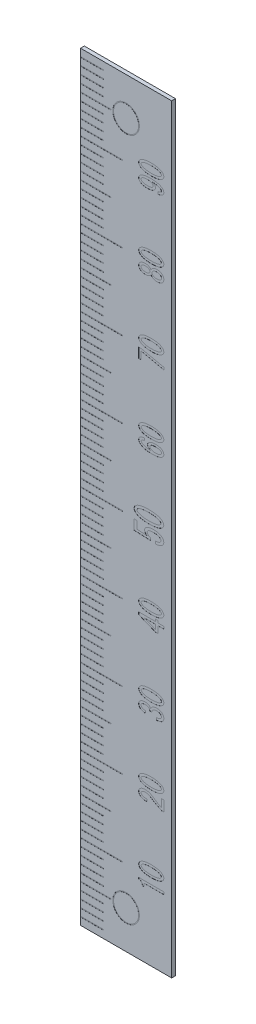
SolidWorks part; units mm, degrees
ref_plane "Front" through (0, 0, 0) normal (0, 0, 1) x (1, 0, 0)
ref_plane "Top" through (0, 0, 0) normal (0, 1, 0) x (1, 0, 0)
ref_plane "Right" through (0, 0, 0) normal (1, 0, 0) x (0, 0, -1)
sketch "Sketch1" plane through (0, 0, 0) normal (0, 0, 1) x (1, 0, 0)
  line L1 (0, 0) -> (0, 100)
  line L2 (0, 0) -> (12, 0)
  line L3 (12, 0) -> (12, 100)
  line L4 (0, 100) -> (12, 100)
  dimension "D1" = 100
  dimension "D2" = 12
extrude "Extrude1" add sketch "Sketch1" along normal blind 0.5
sketch "Sketch2" plane through (0, 0, 0.5) normal (0, 0, 1) x (1, 0, 0)
  line L0 (0, 100) -> (0, 0) construction
  line L1 (0, 0) -> (12, 0) construction
  line L2 (12, 100) -> (0, 100) construction
  circle A0 centre (6, 5) radius 1.75
  circle A1 centre (6, 95) radius 1.75
  circle A2 centre (6, 5) radius 1.65
  circle A3 centre (6, 95) radius 1.65
  dimension "D1" = 6
  dimension "D2" = 6
  dimension "D3" = 5
  dimension "D4" = 5
  dimension "D5" = 3.5
  dimension "D6" = 3.5
  dimension "D7" = 0.1
extrude "Extrude2" cut sketch "Sketch2" against normal blind 0.01
sketch "Sketch3" plane through (0, 0, 0.5) normal (0, 0, 1) x (1, 0, 0)
  line L0 (12, 100) -> (0, 100) construction
  line L1 (7.5, 88.25) -> (11, 88.25) construction
  line L2 (7.5, 88.25) -> (7.5, 91.75) construction
  line L3 (7.5, 91.75) -> (11, 91.75) construction
  line L4 (11, 88.25) -> (11, 91.75) construction
  line L6 (11, 78.25) -> (11, 81.75) construction
  line L7 (11, 68.25) -> (11, 71.75) construction
  line L8 (11, 58.25) -> (11, 61.75) construction
  line L9 (11, 48.25) -> (11, 51.75) construction
  line L10 (11, 38.25) -> (11, 41.75) construction
  line L11 (11, 28.25) -> (11, 31.75) construction
  line L12 (11, 18.25) -> (11, 21.75) construction
  line L13 (11, 8.25) -> (11, 11.75) construction
  line L14 (12, 0) -> (12, 100) construction
  line L16 (11, -1.75) -> (11, 1.75) construction
  text T0 "90" font "ＭＳ ゴシック" height in points 11
  text T1 "80  " font "ＭＳ ゴシック" height in points 11
  text T2 "70" font "ＭＳ ゴシック" height in points 11
  text T3 "60" font "ＭＳ ゴシック" height in points 11
  text T4 "50" font "ＭＳ ゴシック" height in points 13
  text T5 "40  " font "ＭＳ ゴシック" height in points 11
  text T6 "30" font "ＭＳ ゴシック" height in points 11
  text T7 "20" font "ＭＳ ゴシック" height in points 11
  text T8 "10" font "ＭＳ ゴシック" height in points 11
  point P4 (11, 90)
  dimension "D1" = 3.5
  dimension "D2" = 10
  dimension "D3" = 1
  dimension "D4" = 3.5
  dimension "D5" = 4
  dimension "D6" = 7
extrude "Extrude3" cut sketch "Sketch3" against normal blind 0.01
sketch "Sketch4" plane through (0, 0, 0.5) normal (0, 0, 1) x (1, 0, 0)
  line L5 (12, 100) -> (0, 100) construction
  line L406 (6, 100) -> (6, 0) construction
  line L407 (0, 0) -> (12, 0) construction
  line L408 (3, 1.05) -> (3, 0.95)
  line L409 (0, 0.95) -> (3, 0.95)
  line L410 (0, 1.05) -> (3, 1.05)
  line L411 (0, 1.05) -> (0, 0.95)
  line L412 (3, 2.05) -> (3, 1.95)
  line L413 (0, 1.95) -> (3, 1.95)
  line L414 (0, 2.05) -> (3, 2.05)
  line L415 (0, 2.05) -> (0, 1.95)
  line L416 (3, 3.05) -> (3, 2.95)
  line L417 (0, 2.95) -> (3, 2.95)
  line L418 (0, 3.05) -> (3, 3.05)
  line L419 (0, 3.05) -> (0, 2.95)
  line L420 (3, 4.05) -> (3, 3.95)
  line L421 (0, 3.95) -> (3, 3.95)
  line L422 (0, 4.05) -> (3, 4.05)
  line L423 (0, 4.05) -> (0, 3.95)
  line L424 (3, 6.05) -> (3, 5.95)
  line L425 (0, 5.95) -> (3, 5.95)
  line L426 (0, 6.05) -> (3, 6.05)
  line L427 (0, 6.05) -> (0, 5.95)
  line L428 (3, 7.05) -> (3, 6.95)
  line L429 (0, 6.95) -> (3, 6.95)
  line L430 (0, 7.05) -> (3, 7.05)
  line L431 (0, 7.05) -> (0, 6.95)
  line L432 (3, 8.05) -> (3, 7.95)
  line L433 (0, 7.95) -> (3, 7.95)
  line L434 (0, 8.05) -> (3, 8.05)
  line L435 (3, 9.05) -> (3, 8.95)
  line L436 (0, 8.95) -> (3, 8.95)
  line L437 (0, 9.05) -> (0, 8.95)
  line L438 (0, 9.05) -> (3, 9.05)
  line L439 (4, 4.95) -> (4, 5.05)
  line L440 (0, 5.05) -> (4, 5.05)
  line L441 (0, 4.95) -> (0, 5.05)
  line L442 (0, 4.95) -> (4, 4.95)
  line L443 (0, 8.05) -> (0, 7.95)
  line L444 (0, 9.95) -> (0, 10.05)
  line L445 (5.5, 9.95) -> (0, 9.95)
  line L446 (5.5, 10.05) -> (5.5, 9.95)
  line L447 (0, 10.05) -> (5.5, 10.05)
  line L448 (3, 11.05) -> (3, 10.95)
  line L449 (0, 10.95) -> (3, 10.95)
  line L450 (0, 11.05) -> (3, 11.05)
  line L451 (0, 11.05) -> (0, 10.95)
  line L452 (3, 12.05) -> (3, 11.95)
  line L453 (0, 11.95) -> (3, 11.95)
  line L454 (0, 12.05) -> (3, 12.05)
  line L455 (0, 12.05) -> (0, 11.95)
  line L456 (3, 13.05) -> (3, 12.95)
  line L457 (0, 12.95) -> (3, 12.95)
  line L458 (0, 13.05) -> (3, 13.05)
  line L459 (0, 13.05) -> (0, 12.95)
  line L460 (3, 14.05) -> (3, 13.95)
  line L461 (0, 13.95) -> (3, 13.95)
  line L462 (0, 14.05) -> (3, 14.05)
  line L463 (0, 14.05) -> (0, 13.95)
  line L464 (3, 16.05) -> (3, 15.95)
  line L465 (0, 15.95) -> (3, 15.95)
  line L466 (0, 16.05) -> (3, 16.05)
  line L467 (0, 16.05) -> (0, 15.95)
  line L468 (3, 17.05) -> (3, 16.95)
  line L469 (0, 16.95) -> (3, 16.95)
  line L470 (0, 17.05) -> (3, 17.05)
  line L471 (0, 17.05) -> (0, 16.95)
  line L472 (3, 18.05) -> (3, 17.95)
  line L473 (0, 17.95) -> (3, 17.95)
  line L474 (0, 18.05) -> (3, 18.05)
  line L475 (3, 19.05) -> (3, 18.95)
  line L476 (0, 18.95) -> (3, 18.95)
  line L477 (0, 19.05) -> (0, 18.95)
  line L478 (0, 19.05) -> (3, 19.05)
  line L479 (4, 14.95) -> (4, 15.05)
  line L480 (0, 15.05) -> (4, 15.05)
  line L481 (0, 14.95) -> (0, 15.05)
  line L482 (0, 14.95) -> (4, 14.95)
  line L483 (0, 18.05) -> (0, 17.95)
  line L484 (0, 19.95) -> (0, 20.05)
  line L485 (5.5, 19.95) -> (0, 19.95)
  line L486 (5.5, 20.05) -> (5.5, 19.95)
  line L487 (0, 20.05) -> (5.5, 20.05)
  line L488 (3, 21.05) -> (3, 20.95)
  line L489 (0, 20.95) -> (3, 20.95)
  line L490 (0, 21.05) -> (3, 21.05)
  line L491 (0, 21.05) -> (0, 20.95)
  line L492 (3, 22.05) -> (3, 21.95)
  line L493 (0, 21.95) -> (3, 21.95)
  line L494 (0, 22.05) -> (3, 22.05)
  line L495 (0, 22.05) -> (0, 21.95)
  line L496 (3, 23.05) -> (3, 22.95)
  line L497 (0, 22.95) -> (3, 22.95)
  line L498 (0, 23.05) -> (3, 23.05)
  line L499 (0, 23.05) -> (0, 22.95)
  line L500 (3, 24.05) -> (3, 23.95)
  line L501 (0, 23.95) -> (3, 23.95)
  line L502 (0, 24.05) -> (3, 24.05)
  line L503 (0, 24.05) -> (0, 23.95)
  line L504 (3, 26.05) -> (3, 25.95)
  line L505 (0, 25.95) -> (3, 25.95)
  line L506 (0, 26.05) -> (3, 26.05)
  line L507 (0, 26.05) -> (0, 25.95)
  line L508 (3, 27.05) -> (3, 26.95)
  line L509 (0, 26.95) -> (3, 26.95)
  line L510 (0, 27.05) -> (3, 27.05)
  line L511 (0, 27.05) -> (0, 26.95)
  line L512 (3, 28.05) -> (3, 27.95)
  line L513 (0, 27.95) -> (3, 27.95)
  line L514 (0, 28.05) -> (3, 28.05)
  line L515 (3, 29.05) -> (3, 28.95)
  line L516 (0, 28.95) -> (3, 28.95)
  line L517 (0, 29.05) -> (0, 28.95)
  line L518 (0, 29.05) -> (3, 29.05)
  line L519 (4, 24.95) -> (4, 25.05)
  line L520 (0, 25.05) -> (4, 25.05)
  line L521 (0, 24.95) -> (0, 25.05)
  line L522 (0, 24.95) -> (4, 24.95)
  line L523 (0, 28.05) -> (0, 27.95)
  line L524 (0, 29.95) -> (0, 30.05)
  line L525 (5.5, 29.95) -> (0, 29.95)
  line L526 (5.5, 30.05) -> (5.5, 29.95)
  line L527 (0, 30.05) -> (5.5, 30.05)
  line L528 (3, 31.05) -> (3, 30.95)
  line L529 (0, 30.95) -> (3, 30.95)
  line L530 (0, 31.05) -> (3, 31.05)
  line L531 (0, 31.05) -> (0, 30.95)
  line L532 (3, 32.05) -> (3, 31.95)
  line L533 (0, 31.95) -> (3, 31.95)
  line L534 (0, 32.05) -> (3, 32.05)
  line L535 (0, 32.05) -> (0, 31.95)
  line L536 (3, 33.05) -> (3, 32.95)
  line L537 (0, 32.95) -> (3, 32.95)
  line L538 (0, 33.05) -> (3, 33.05)
  line L539 (0, 33.05) -> (0, 32.95)
  line L540 (3, 34.05) -> (3, 33.95)
  line L541 (0, 33.95) -> (3, 33.95)
  line L542 (0, 34.05) -> (3, 34.05)
  line L543 (0, 34.05) -> (0, 33.95)
  line L544 (3, 36.05) -> (3, 35.95)
  line L545 (0, 35.95) -> (3, 35.95)
  line L546 (0, 36.05) -> (3, 36.05)
  line L547 (0, 36.05) -> (0, 35.95)
  line L548 (3, 37.05) -> (3, 36.95)
  line L549 (0, 36.95) -> (3, 36.95)
  line L550 (0, 37.05) -> (3, 37.05)
  line L551 (0, 37.05) -> (0, 36.95)
  line L552 (3, 38.05) -> (3, 37.95)
  line L553 (0, 37.95) -> (3, 37.95)
  line L554 (0, 38.05) -> (3, 38.05)
  line L555 (3, 39.05) -> (3, 38.95)
  line L556 (0, 38.95) -> (3, 38.95)
  line L557 (0, 39.05) -> (0, 38.95)
  line L558 (0, 39.05) -> (3, 39.05)
  line L559 (4, 34.95) -> (4, 35.05)
  line L560 (0, 35.05) -> (4, 35.05)
  line L561 (0, 34.95) -> (0, 35.05)
  line L562 (0, 34.95) -> (4, 34.95)
  line L563 (0, 38.05) -> (0, 37.95)
  line L564 (0, 39.95) -> (0, 40.05)
  line L565 (5.5, 39.95) -> (0, 39.95)
  line L566 (5.5, 40.05) -> (5.5, 39.95)
  line L567 (0, 40.05) -> (5.5, 40.05)
  line L568 (3, 41.05) -> (3, 40.95)
  line L569 (0, 40.95) -> (3, 40.95)
  line L570 (0, 41.05) -> (3, 41.05)
  line L571 (0, 41.05) -> (0, 40.95)
  line L572 (3, 42.05) -> (3, 41.95)
  line L573 (0, 41.95) -> (3, 41.95)
  line L574 (0, 42.05) -> (3, 42.05)
  line L575 (0, 42.05) -> (0, 41.95)
  line L576 (3, 43.05) -> (3, 42.95)
  line L577 (0, 42.95) -> (3, 42.95)
  line L578 (0, 43.05) -> (3, 43.05)
  line L579 (0, 43.05) -> (0, 42.95)
  line L580 (3, 44.05) -> (3, 43.95)
  line L581 (0, 43.95) -> (3, 43.95)
  line L582 (0, 44.05) -> (3, 44.05)
  line L583 (0, 44.05) -> (0, 43.95)
  line L584 (3, 46.05) -> (3, 45.95)
  line L585 (0, 45.95) -> (3, 45.95)
  line L586 (0, 46.05) -> (3, 46.05)
  line L587 (0, 46.05) -> (0, 45.95)
  line L588 (3, 47.05) -> (3, 46.95)
  line L589 (0, 46.95) -> (3, 46.95)
  line L590 (0, 47.05) -> (3, 47.05)
  line L591 (0, 47.05) -> (0, 46.95)
  line L592 (3, 48.05) -> (3, 47.95)
  line L593 (0, 47.95) -> (3, 47.95)
  line L594 (0, 48.05) -> (3, 48.05)
  line L595 (3, 49.05) -> (3, 48.95)
  line L596 (0, 48.95) -> (3, 48.95)
  line L597 (0, 49.05) -> (0, 48.95)
  line L598 (0, 49.05) -> (3, 49.05)
  line L599 (4, 44.95) -> (4, 45.05)
  line L600 (0, 45.05) -> (4, 45.05)
  line L601 (0, 44.95) -> (0, 45.05)
  line L602 (0, 44.95) -> (4, 44.95)
  line L603 (0, 48.05) -> (0, 47.95)
  line L604 (3, 51.05) -> (3, 50.95)
  line L605 (0, 50.95) -> (3, 50.95)
  line L606 (0, 51.05) -> (3, 51.05)
  line L607 (0, 51.05) -> (0, 50.95)
  line L608 (3, 52.05) -> (3, 51.95)
  line L609 (0, 51.95) -> (3, 51.95)
  line L610 (0, 52.05) -> (3, 52.05)
  line L611 (0, 52.05) -> (0, 51.95)
  line L612 (3, 53.05) -> (3, 52.95)
  line L613 (0, 52.95) -> (3, 52.95)
  line L614 (0, 53.05) -> (3, 53.05)
  line L615 (0, 53.05) -> (0, 52.95)
  line L616 (3, 54.05) -> (3, 53.95)
  line L617 (0, 53.95) -> (3, 53.95)
  line L618 (0, 54.05) -> (3, 54.05)
  line L619 (0, 54.05) -> (0, 53.95)
  line L620 (3, 56.05) -> (3, 55.95)
  line L621 (0, 55.95) -> (3, 55.95)
  line L622 (0, 56.05) -> (3, 56.05)
  line L623 (0, 56.05) -> (0, 55.95)
  line L624 (3, 57.05) -> (3, 56.95)
  line L625 (0, 56.95) -> (3, 56.95)
  line L626 (0, 57.05) -> (3, 57.05)
  line L627 (0, 57.05) -> (0, 56.95)
  line L628 (3, 58.05) -> (3, 57.95)
  line L629 (0, 57.95) -> (3, 57.95)
  line L630 (0, 58.05) -> (3, 58.05)
  line L631 (3, 59.05) -> (3, 58.95)
  line L632 (0, 58.95) -> (3, 58.95)
  line L633 (0, 59.05) -> (0, 58.95)
  line L634 (0, 59.05) -> (3, 59.05)
  line L635 (4, 54.95) -> (4, 55.05)
  line L636 (0, 55.05) -> (4, 55.05)
  line L637 (0, 54.95) -> (0, 55.05)
  line L638 (0, 54.95) -> (4, 54.95)
  line L639 (0, 58.05) -> (0, 57.95)
  line L640 (0, 49.95) -> (0, 50.05)
  line L641 (5.5, 49.95) -> (0, 49.95)
  line L642 (5.5, 50.05) -> (5.5, 49.95)
  line L643 (0, 50.05) -> (5.5, 50.05)
  line L644 (3, 61.05) -> (3, 60.95)
  line L645 (0, 60.95) -> (3, 60.95)
  line L646 (0, 61.05) -> (3, 61.05)
  line L647 (0, 61.05) -> (0, 60.95)
  line L648 (3, 62.05) -> (3, 61.95)
  line L649 (0, 61.95) -> (3, 61.95)
  line L650 (0, 62.05) -> (3, 62.05)
  line L651 (0, 62.05) -> (0, 61.95)
  line L652 (3, 63.05) -> (3, 62.95)
  line L653 (0, 62.95) -> (3, 62.95)
  line L654 (0, 63.05) -> (3, 63.05)
  line L655 (0, 63.05) -> (0, 62.95)
  line L656 (3, 64.05) -> (3, 63.95)
  line L657 (0, 63.95) -> (3, 63.95)
  line L658 (0, 64.05) -> (3, 64.05)
  line L659 (0, 64.05) -> (0, 63.95)
  line L660 (3, 66.05) -> (3, 65.95)
  line L661 (0, 65.95) -> (3, 65.95)
  line L662 (0, 66.05) -> (3, 66.05)
  line L663 (0, 66.05) -> (0, 65.95)
  line L664 (3, 67.05) -> (3, 66.95)
  line L665 (0, 66.95) -> (3, 66.95)
  line L666 (0, 67.05) -> (3, 67.05)
  line L667 (0, 67.05) -> (0, 66.95)
  line L668 (3, 68.05) -> (3, 67.95)
  line L669 (0, 67.95) -> (3, 67.95)
  line L670 (0, 68.05) -> (3, 68.05)
  line L671 (3, 69.05) -> (3, 68.95)
  line L672 (0, 68.95) -> (3, 68.95)
  line L673 (0, 69.05) -> (0, 68.95)
  line L674 (0, 69.05) -> (3, 69.05)
  line L675 (4, 64.95) -> (4, 65.05)
  line L676 (0, 65.05) -> (4, 65.05)
  line L677 (0, 64.95) -> (0, 65.05)
  line L678 (0, 64.95) -> (4, 64.95)
  line L679 (0, 68.05) -> (0, 67.95)
  line L680 (0, 59.95) -> (0, 60.05)
  line L681 (5.5, 59.95) -> (0, 59.95)
  line L682 (5.5, 60.05) -> (5.5, 59.95)
  line L683 (0, 60.05) -> (5.5, 60.05)
  line L684 (3, 71.05) -> (3, 70.95)
  line L685 (0, 70.95) -> (3, 70.95)
  line L686 (0, 71.05) -> (3, 71.05)
  line L687 (0, 71.05) -> (0, 70.95)
  line L688 (3, 72.05) -> (3, 71.95)
  line L689 (0, 71.95) -> (3, 71.95)
  line L690 (0, 72.05) -> (3, 72.05)
  line L691 (0, 72.05) -> (0, 71.95)
  line L692 (3, 73.05) -> (3, 72.95)
  line L693 (0, 72.95) -> (3, 72.95)
  line L694 (0, 73.05) -> (3, 73.05)
  line L695 (0, 73.05) -> (0, 72.95)
  line L696 (3, 74.05) -> (3, 73.95)
  line L697 (0, 73.95) -> (3, 73.95)
  line L698 (0, 74.05) -> (3, 74.05)
  line L699 (0, 74.05) -> (0, 73.95)
  line L700 (3, 76.05) -> (3, 75.95)
  line L701 (0, 75.95) -> (3, 75.95)
  line L702 (0, 76.05) -> (3, 76.05)
  line L703 (0, 76.05) -> (0, 75.95)
  line L704 (3, 77.05) -> (3, 76.95)
  line L705 (0, 76.95) -> (3, 76.95)
  line L706 (0, 77.05) -> (3, 77.05)
  line L707 (0, 77.05) -> (0, 76.95)
  line L708 (3, 78.05) -> (3, 77.95)
  line L709 (0, 77.95) -> (3, 77.95)
  line L710 (0, 78.05) -> (3, 78.05)
  line L711 (3, 79.05) -> (3, 78.95)
  line L712 (0, 78.95) -> (3, 78.95)
  line L713 (0, 79.05) -> (0, 78.95)
  line L714 (0, 79.05) -> (3, 79.05)
  line L715 (4, 74.95) -> (4, 75.05)
  line L716 (0, 75.05) -> (4, 75.05)
  line L717 (0, 74.95) -> (0, 75.05)
  line L718 (0, 74.95) -> (4, 74.95)
  line L719 (0, 78.05) -> (0, 77.95)
  line L720 (0, 69.95) -> (0, 70.05)
  line L721 (5.5, 69.95) -> (0, 69.95)
  line L722 (5.5, 70.05) -> (5.5, 69.95)
  line L723 (0, 70.05) -> (5.5, 70.05)
  line L724 (3, 81.05) -> (3, 80.95)
  line L725 (0, 80.95) -> (3, 80.95)
  line L726 (0, 81.05) -> (3, 81.05)
  line L727 (0, 81.05) -> (0, 80.95)
  line L728 (3, 82.05) -> (3, 81.95)
  line L729 (0, 81.95) -> (3, 81.95)
  line L730 (0, 82.05) -> (3, 82.05)
  line L731 (0, 82.05) -> (0, 81.95)
  line L732 (3, 83.05) -> (3, 82.95)
  line L733 (0, 82.95) -> (3, 82.95)
  line L734 (0, 83.05) -> (3, 83.05)
  line L735 (0, 83.05) -> (0, 82.95)
  line L736 (3, 84.05) -> (3, 83.95)
  line L737 (0, 83.95) -> (3, 83.95)
  line L738 (0, 84.05) -> (3, 84.05)
  line L739 (0, 84.05) -> (0, 83.95)
  line L740 (3, 86.05) -> (3, 85.95)
  line L741 (0, 85.95) -> (3, 85.95)
  line L742 (0, 86.05) -> (3, 86.05)
  line L743 (0, 86.05) -> (0, 85.95)
  line L744 (3, 87.05) -> (3, 86.95)
  line L745 (0, 86.95) -> (3, 86.95)
  line L746 (0, 87.05) -> (3, 87.05)
  line L747 (0, 87.05) -> (0, 86.95)
  line L748 (3, 88.05) -> (3, 87.95)
  line L749 (0, 87.95) -> (3, 87.95)
  line L750 (0, 88.05) -> (3, 88.05)
  line L751 (3, 89.05) -> (3, 88.95)
  line L752 (0, 88.95) -> (3, 88.95)
  line L753 (0, 89.05) -> (0, 88.95)
  line L754 (0, 89.05) -> (3, 89.05)
  line L755 (4, 84.95) -> (4, 85.05)
  line L756 (0, 85.05) -> (4, 85.05)
  line L757 (0, 84.95) -> (0, 85.05)
  line L758 (0, 84.95) -> (4, 84.95)
  line L759 (0, 88.05) -> (0, 87.95)
  line L760 (3, 91.05) -> (3, 90.95)
  line L761 (0, 90.95) -> (3, 90.95)
  line L762 (0, 91.05) -> (3, 91.05)
  line L763 (0, 91.05) -> (0, 90.95)
  line L764 (3, 92.05) -> (3, 91.95)
  line L765 (0, 91.95) -> (3, 91.95)
  line L766 (0, 92.05) -> (3, 92.05)
  line L767 (0, 92.05) -> (0, 91.95)
  line L768 (3, 93.05) -> (3, 92.95)
  line L769 (0, 92.95) -> (3, 92.95)
  line L770 (0, 93.05) -> (3, 93.05)
  line L771 (0, 93.05) -> (0, 92.95)
  line L772 (3, 94.05) -> (3, 93.95)
  line L773 (0, 93.95) -> (3, 93.95)
  line L774 (0, 94.05) -> (3, 94.05)
  line L775 (0, 94.05) -> (0, 93.95)
  line L776 (0, 79.95) -> (0, 80.05)
  line L777 (5.5, 79.95) -> (0, 79.95)
  line L778 (5.5, 80.05) -> (5.5, 79.95)
  line L779 (0, 80.05) -> (5.5, 80.05)
  line L780 (3, 96.05) -> (3, 95.95)
  line L781 (0, 95.95) -> (3, 95.95)
  line L782 (0, 96.05) -> (3, 96.05)
  line L783 (0, 96.05) -> (0, 95.95)
  line L784 (3, 97.05) -> (3, 96.95)
  line L785 (0, 96.95) -> (3, 96.95)
  line L786 (0, 97.05) -> (3, 97.05)
  line L787 (0, 97.05) -> (0, 96.95)
  line L788 (3, 98.05) -> (3, 97.95)
  line L789 (0, 97.95) -> (3, 97.95)
  line L790 (0, 98.05) -> (3, 98.05)
  line L791 (3, 99.05) -> (3, 98.95)
  line L792 (0, 98.95) -> (3, 98.95)
  line L793 (0, 99.05) -> (0, 98.95)
  line L794 (0, 99.05) -> (3, 99.05)
  line L795 (4, 94.95) -> (4, 95.05)
  line L796 (0, 95.05) -> (4, 95.05)
  line L797 (0, 94.95) -> (0, 95.05)
  line L798 (0, 94.95) -> (4, 94.95)
  line L799 (0, 98.05) -> (0, 97.95)
  line L800 (0, 89.95) -> (0, 90.05)
  line L801 (5.5, 89.95) -> (0, 89.95)
  line L802 (5.5, 90.05) -> (5.5, 89.95)
  line L803 (0, 90.05) -> (5.5, 90.05)
extrude "Extrude4" cut sketch "Sketch4" against normal blind 0.01
move or copy body "Body-Move/Copy2" bodies to move or copy 105 copy no translate (-12, -50, 0)
move or copy body "Body-Move/Copy3" bodies to move or copy 107 copy no translate (0, 50, 0)
